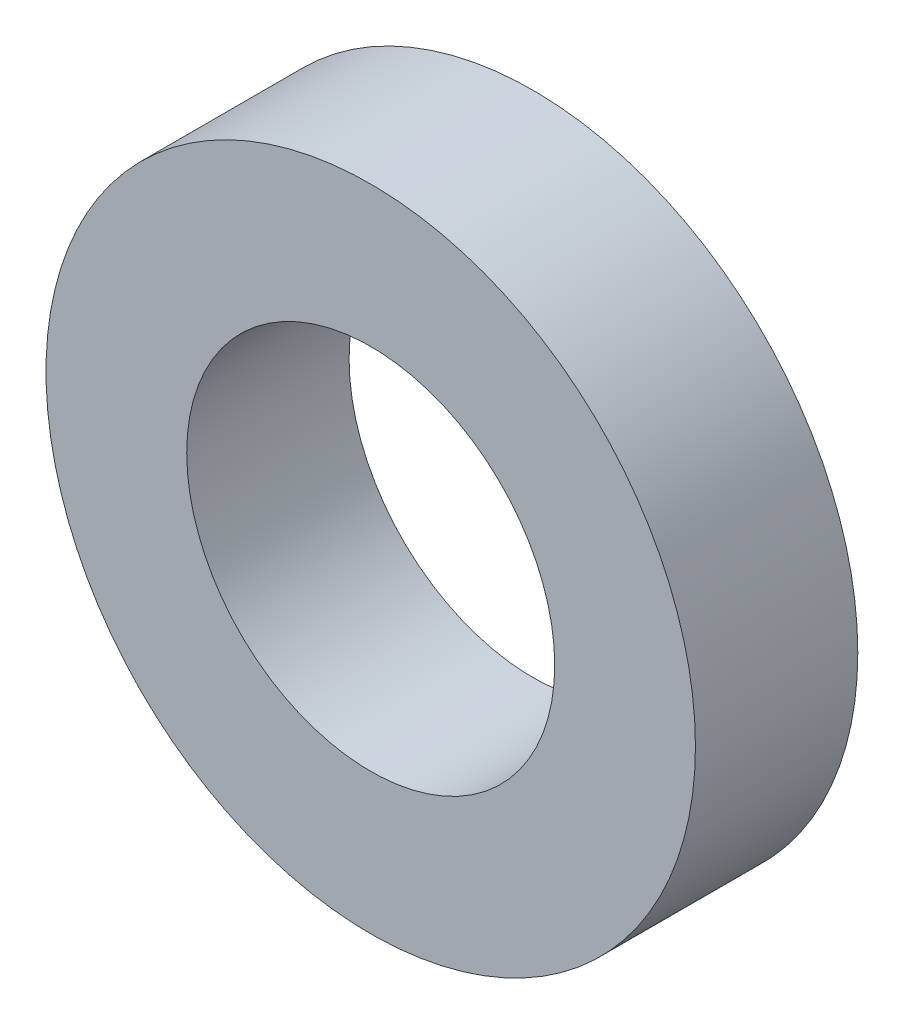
SolidWorks part; units mm, degrees
ref_plane "前视基准面" through (0, 0, 0) normal (0, 0, 1) x (1, 0, 0)
ref_plane "上视基准面" through (0, 0, 0) normal (0, 1, 0) x (1, 0, 0)
ref_plane "右视基准面" through (0, 0, 0) normal (1, 0, 0) x (0, 0, -1)
sketch "草图1" plane through (0, 0, 0) normal (0, 0, 1) x (1, 0, 0)
  circle A0 centre (0, 0) radius 3
  circle A1 centre (0, 0) radius 1.7
  dimension "D1" = 6
  dimension "D2" = 3.4
extrude "凸台-拉伸1" add sketch "草图1" along normal blind 1.5
